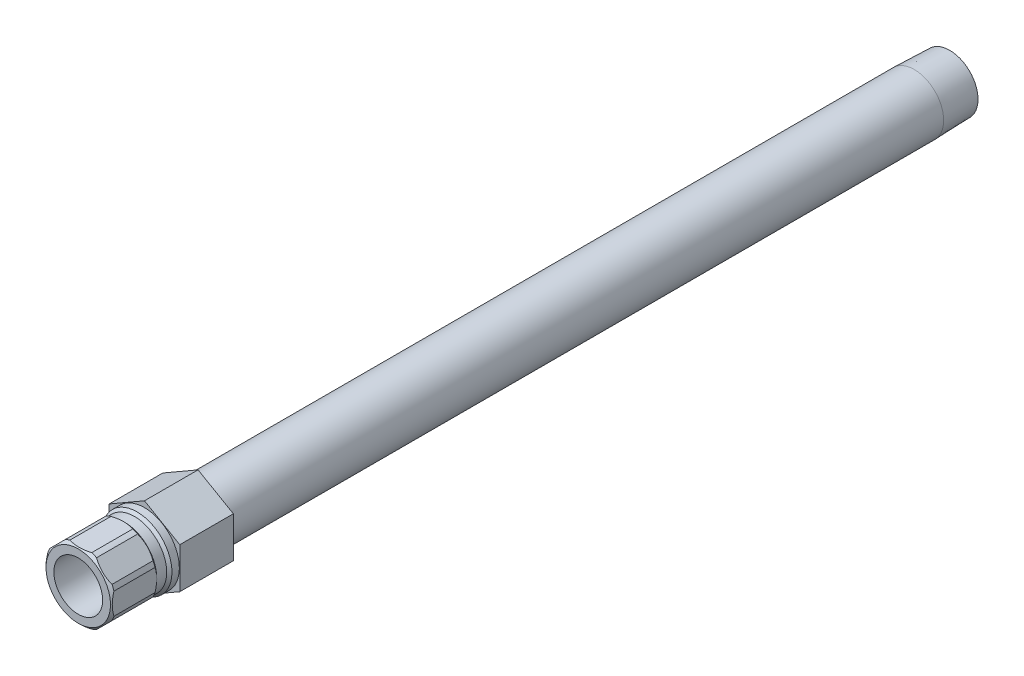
SolidWorks part; units mm, degrees
ref_plane "Front Plane" through (0, 0, 0) normal (0, 0, 1) x (1, 0, 0)
ref_plane "Top Plane" through (0, 0, 0) normal (0, 1, 0) x (1, 0, 0)
ref_plane "Right Plane" through (0, 0, 0) normal (1, 0, 0) x (0, 0, -1)
sketch "Sketch1" plane through (0, 0, 0) normal (1, 0, 0) x (0, 0, -1)
  line L0 (0, 0) -> (-22.479, 0) construction
  line L1 (-19.304, 7.112) -> (-19.304, 9.398)
  line L2 (-5.8166, 9.398) -> (-5.8166, 0) construction
  line L3 (-18.542, 10.16) -> (-6.5786, 10.16)
  line L4 (0, 8.5725) -> (0, 0) construction
  line L5 (-5.8166, 9.398) -> (-2.921, 9.398)
  line L6 (-2.159, 10.16) -> (0, 10.16)
  line L7 (0, 10.16) -> (0, 8.5725)
  line L8 (-5.8166, 9.398) -> (-6.5786, 10.16)
  line L9 (-2.921, 9.398) -> (-2.159, 10.16)
  line L10 (-19.304, 9.398) -> (-18.542, 10.16)
  line L11 (-19.304, 7.112) -> (-1.524, 7.112)
  line L12 (0, 8.5725) -> (224.3582, 8.5725)
  line L13 (224.3582, 8.5725) -> (234.696, 8.2494)
  line L14 (234.696, 8.2494) -> (234.696, 6.2611)
  line L15 (0, 10.16) -> (15.621, 10.16) construction
  line L16 (15.621, 10.16) -> (15.621, 7.112) construction
  line L17 (9.271, 0) -> (0, 0) construction
  line L18 (-1.524, 7.112) -> (-0.6731, 6.2611)
  line L19 (-0.6731, 6.2611) -> (234.696, 6.2611)
  dimension "D1" = 19.304
  dimension "D2" = 2.8956
  dimension "D3" = 0.762
  dimension "D4" = 45
  dimension "D5" = 13.4874
  dimension "D6" = 45
  dimension "D7" = 1.79
  dimension "D8" = 10.3378
  dimension "D9" = 254
  dimension "D10" = 3.175
  dimension "D11" = 34.925
  dimension "D12" = 14.224
  dimension "D13" = 17.145
  dimension "D14" = 20.32
  dimension "D15" = 12.5222
  dimension "D16" = 17.78
revolve "Revolve1" add sketch "Sketch1" angle 360 about L0
sketch "Sketch2" plane through (0, 0, 0) normal (0, 0, 1) x (1, 0, 0)
  line L1 (-10.287, 5.9392) -> (-10.287, -5.9392)
  line L2 (-10.287, -5.9392) -> (0, -11.8784)
  line L3 (0, -11.8784) -> (10.287, -5.9392)
  line L4 (10.287, -5.9392) -> (10.287, 5.9392)
  line L5 (10.287, 5.9392) -> (0, 11.8784)
  line L6 (0, 11.8784) -> (-10.287, 5.9392)
  circle A0 centre (0, 0) radius 10.287 construction
  circle A1 centre (0, 0) radius 6.2611 construction
  circle A2 centre (0, 0) radius 6.2611
  dimension "D1" = 20.574
extrude "Boss-Extrude1" add sketch "Sketch2" against normal up to vertex (15.621 mm away) from vertex at 0
sketch "Sketch3" plane through (0, 0, 0) normal (0, 0, 1) x (1, 0, 0)
  line L1 (9.652, -3.998) -> (9.652, 3.998)
  line L2 (9.652, 3.998) -> (3.998, 9.652)
  line L3 (3.998, 9.652) -> (-3.998, 9.652)
  line L4 (-3.998, 9.652) -> (-9.652, 3.998)
  line L5 (-9.652, 3.998) -> (-9.652, -3.998)
  line L6 (-9.652, -3.998) -> (-3.998, -9.652)
  line L7 (-3.998, -9.652) -> (3.998, -9.652)
  line L8 (3.998, -9.652) -> (9.652, -3.998)
  circle A0 centre (0, 0) radius 9.652 construction
  dimension "D1" = 19.304
extrude "Cut-Extrude1" cut sketch "Sketch3" along normal through all from vertex at 5.8166 flip side to cut
